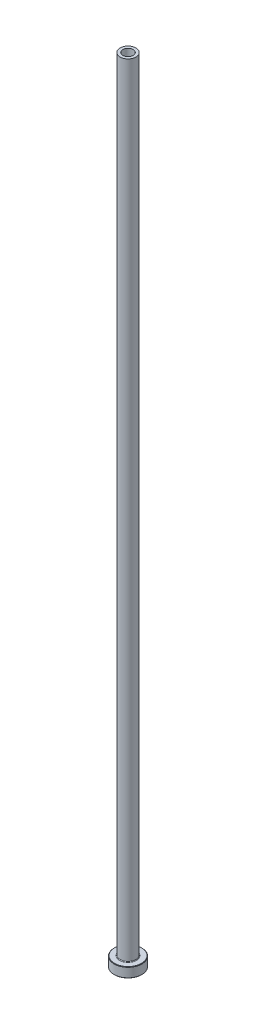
SolidWorks part; units mm, degrees
ref_plane "Front Plane" through (0, 0, 0) normal (0, 0, 1) x (1, 0, 0)
ref_plane "Top Plane" through (0, 0, 0) normal (0, 1, 0) x (1, 0, 0)
ref_plane "Right Plane" through (0, 0, 0) normal (1, 0, 0) x (0, 0, -1)
sketch "Sketch1" plane through (0, 0, 0) normal (0, 0, 1) x (1, 0, 0)
  line L0 (-2.6, 400) -> (-4, 400)
  line L1 (-4, 400) -> (-4, 5)
  line L2 (-4, 5) -> (-7, 5)
  line L3 (-7, 5) -> (-7, 0)
  line L4 (7.7, 0) -> (-7.7, 0) construction
  line L5 (-7, 0) -> (-2.85, 0)
  line L6 (-2.6, 355) -> (-2.6, 400)
  line L7 (0, 92.1877) -> (0, -15.5353) construction
  line L8 (0, -7.7) -> (0, 7.7) construction
  line L9 (-2.6, 355) -> (-2.85, 343)
  line L10 (-2.85, 343) -> (-2.85, 0)
  dimension "D1" = 0.25
  dimension "ID" = 5.2
  dimension "OD" = 8
  dimension "L" = 400
  dimension "H" = 14
  dimension "T" = 5
  dimension "N" = 45
  dimension "D2" = 12
revolve "Revolve1" add sketch "Sketch1" angle 360 about L7
fillet "Fillet1" radius 0.3 1 edges at (0, 5, 4)
chamfer "Chamfer1" distance 0.2 angle 45 2 edges at (0, 5, 7) (0, 0, 7)
chamfer "Chamfer3" distance 0.5 angle 45 1 edges at (0, 0, 2.85)
